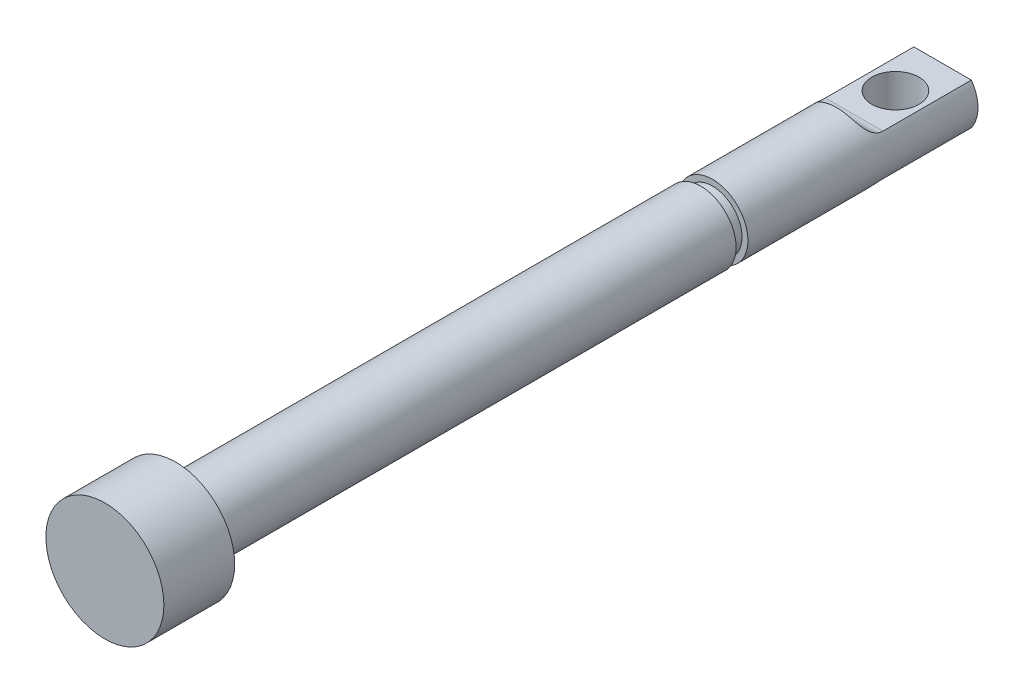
SolidWorks part; units mm, degrees
ref_plane "Face" through (0, 0, 0) normal (0, 0, 1) x (1, 0, 0)
ref_plane "Dessus" through (0, 0, 0) normal (0, 1, 0) x (1, 0, 0)
ref_plane "Droite" through (0, 0, 0) normal (1, 0, 0) x (0, 0, -1)
sketch "Esquisse1" plane through (0, 0, 0) normal (0, 0, 1) x (1, 0, 0)
  circle A0 centre (0, 0) radius 6
  dimension "D1" = 12
extrude "Base-Extrusion" add sketch "Esquisse1" along normal mid plane 130
sketch "Esquisse4" plane through (0, 0, 0) normal (0, 1, 0) x (1, 0, 0)
  line L0 (0, -65) -> (0, 65) construction
  line L1 (6, 65) -> (-6, 65) construction
  circle A0 centre (0, 57) radius 4
  dimension "D1" = 8
  dimension "D2" = 8
extrude "Enlèv. mat.-Extru.1" cut sketch "Esquisse4" against normal through all and the other way through all
sketch "Esquisse5" plane through (0, 0, 65) normal (0, 0, 1) x (1, 0, 0)
  circle A0 centre (0, 0) radius 10
  dimension "D1" = 20
extrude "Boss.-Extru.2" add sketch "Esquisse5" along normal blind 12
sketch "Esquisse6" plane through (0, 0, 65) normal (0, 0, -1) x (-1, 0, 0)
  circle A0 centre (0, 0) radius 7.5
  dimension "D1" = 15
sketch "Esquisse7" plane through (0, 0, 0) normal (1, 0, 0) x (0, 0, -1)
  line L0 (45.4209, 0) -> (-16.5383, 0) construction
  line L1 (26, 8.2981) -> (24, 8.2981)
  line L2 (26, 8.2981) -> (26, 5)
  line L3 (26, 5) -> (24, 5)
  line L4 (24, 8.2981) -> (24, 5)
  line L5 (-65, -10) -> (-65, 10) construction
  dimension "D1" = 2
  dimension "D2" = 89
  dimension "D3" = 10
revolve "Enlèvement de matière-Révolution1" cut sketch "Esquisse7" angle 360 about L0
sketch "Esquisse8" plane through (0, 0, 0) normal (1, 0, 0) x (0, 0, -1)
  line L0 (65, -6) -> (65, 6) construction
  line L1 (72.2983, 19.3174) -> (47, 19.3174)
  line L2 (72.2983, 19.3174) -> (72.2983, 3.5)
  line L3 (72.2983, 3.5) -> (50, 3.5)
  line L4 (47, 19.3174) -> (47, 6.5)
  line L5 (47, -24.2133) -> (84.2968, -24.2133)
  line L6 (47, -24.2133) -> (47, -6.5)
  line L7 (50, -3.5) -> (84.2968, -3.5)
  line L8 (84.2968, -24.2133) -> (84.2968, -3.5)
  arc A0 (47, 6.5) -> (50, 3.5) centre (50, 6.5) ccw
  arc A1 (47, -6.5) -> (50, -3.5) centre (50, -6.5) cw
  dimension "D4" = 3
  dimension "D5" = 3
  dimension "D1" = 7
  dimension "D2" = 3.5
  dimension "D3" = 18
extrude "Enlèv. mat.-Extru.2" cut sketch "Esquisse8" against normal through all and the other way through all
